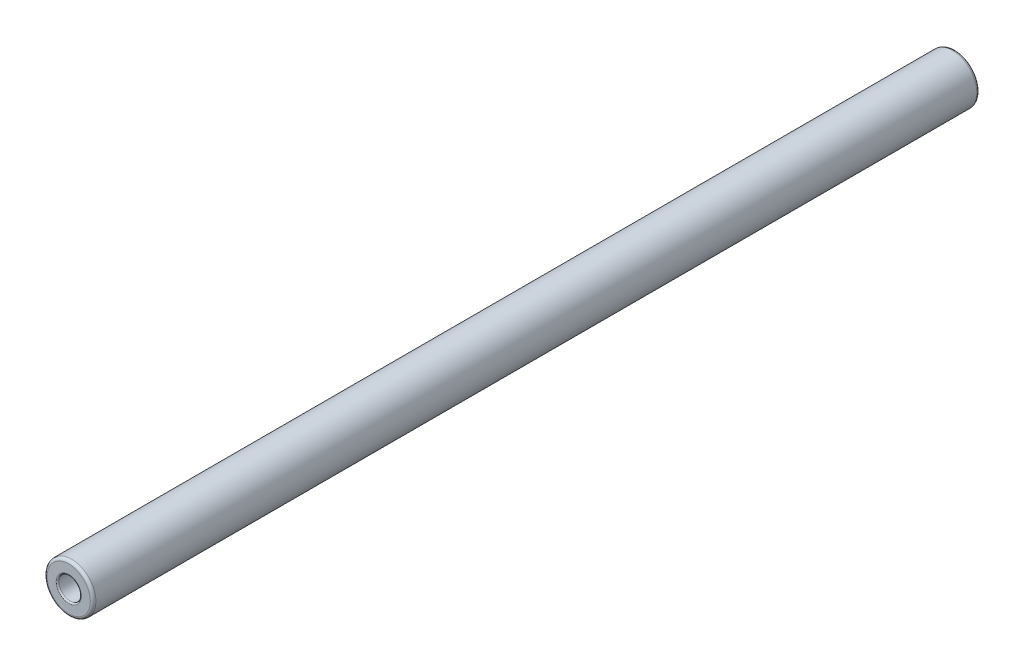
SolidWorks part; units mm, degrees
ref_plane "Piano frontale" through (0, 0, 0) normal (0, 0, 1) x (1, 0, 0)
ref_plane "Piano superiore" through (0, 0, 0) normal (0, 1, 0) x (1, 0, 0)
ref_plane "Piano destro" through (0, 0, 0) normal (1, 0, 0) x (0, 0, -1)
sketch "Schizzo1" plane through (0, 0, 0) normal (0, 0, 1) x (1, 0, 0)
  circle A0 centre (0, 0) radius 17.5
  dimension "D1" = 35
sketch "Schizzo2" plane through (0, 0, 0) normal (1, 0, 0) x (0, 0, -1)
  line L0 (0, 0) -> (636, 0)
  dimension "D1" = 636
sweep "Sweep1" add profiles "Schizzo1" path "Schizzo2"
sketch "Schizzo3" plane through (0, 0, 0) normal (0, 0, 1) x (1, 0, 0)
  circle A0 centre (0, 0) radius 12
  circle A1 centre (0, 0) radius 17.5
  circle A2 centre (0, 0) radius 17.5 construction
  dimension "D1" = 24
extrude "Taglio-Estrusione1" [suppressed] cut sketch "Schizzo3" against normal blind 112.5
sketch "Schizzo4" plane through (0, 0, -636) normal (0, 0, -1) x (-1, 0, 0)
  circle A0 centre (0, 0) radius 12
  circle A1 centre (0, 0) radius 17.5
  circle A2 centre (0, 0) radius 17.5
  dimension "D2" = 24
  dimension "D1" = 0
extrude "Taglio-Estrusione2" [suppressed] cut sketch "Schizzo4" against normal blind 112.5
fillet "Raccordo1" radius 2 2 edges at (17.5, 0, 0) (17.5, 0, -636)
sketch "Schizzo5" plane through (0, 0, -636) normal (0, 0, -1) x (-1, 0, 0)
  circle A0 centre (0, 0) radius 8
  dimension "D1" = 16
extrude "Taglio-Estrusione3" cut sketch "Schizzo5" against normal blind 75
sketch "Schizzo6" plane through (0, 0, 0) normal (0, 0, 1) x (1, 0, 0)
  circle A1 centre (0, 0) radius 8
  circle A2 centre (0, 0) radius 8
  dimension "D1" = 0
extrude "Taglio-Estrusione4" cut sketch "Schizzo6" against normal blind 75
fillet "Raccordo2" radius 1 2 edges at (-8, 0, -636) (8, 0, 0)
ref_plane "Piano1" through (0, 0, -318) normal (0, 0, -1) x (-1, 0, 0)
sketch "Linee di piegatura1" [suppressed] plane through (0, 0, 0) normal (0, 1, 0) x (1, 0, 0)
sketch "Casella di contorno1" [suppressed] plane through (0, 0, 0) normal (0, 1, 0) x (1, 0, 0)
equation "\"Lam_vern\"= 2 * ( \"SW-Massa\" / \"SW-Densità\" ) / ( \"Spessore\" / 1000 )"
